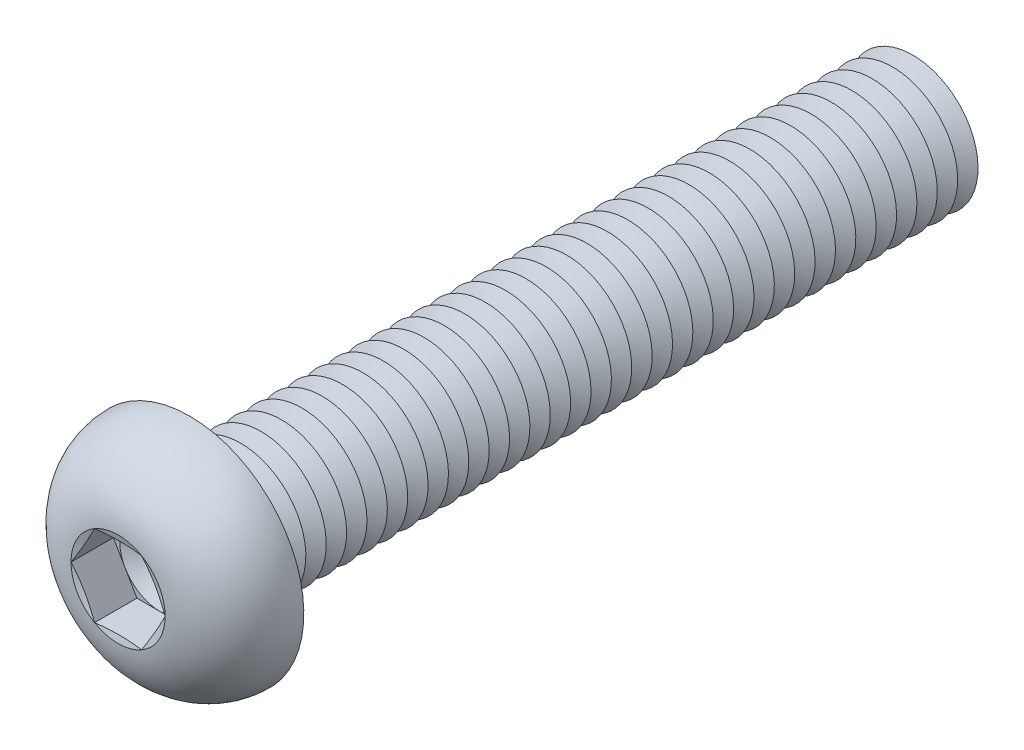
SolidWorks part; units mm, degrees
ref_plane "Front Plane" through (0, 0, 0) normal (0, 0, 1) x (1, 0, 0)
ref_plane "Top Plane" through (0, 0, 0) normal (0, 1, 0) x (1, 0, 0)
ref_plane "Right Plane" through (0, 0, 0) normal (1, 0, 0) x (0, 0, -1)
sketch "Sketch1" plane through (0, 0, 0) normal (1, 0, 0) x (0, 0, -1)
  line L0 (0, 4) -> (0, 7)
  line L3 (0, 4) -> (45, 4)
  line L4 (45, 4) -> (45, 0)
  line L5 (45, 0) -> (-4.4, 0) construction
  line L6 (-4.4, 0) -> (45, 0)
  line L7 (-4.4, 2.8867) -> (-4.4, 1.4434) construction
  line L8 (-4.4, 1.4434) -> (-4.4, 0)
  line L9 (-4.4, 2.8867) -> (-4.0132, 1.4434)
  line L10 (-4.0132, 1.4434) -> (-4.4, 1.4434)
  line L11 (45, 0) -> (22.7481, 0) construction
  line L12 (0, 7) -> (-4.4, 7) construction
  arc A1 (0, 7) -> (-4.4, 2.8867) centre (0, 2.59) ccw
  point P8 (45, 2)
  dimension "D1" = 14
  dimension "D2" = 8
  dimension "D3" = 4.4
  dimension "D4" = 5.7735
  dimension "D5" = 45
  dimension "D6" = 15
revolve "Revolve1" add sketch "Sketch1" angle 360 about L5
fillet "Fillet1" radius 0.625 1 edges at (0, 4, 0)
sketch "Sketch2" plane through (0, 0, 0) normal (1, 0, 0) x (0, 0, -1)
  line L0 (44.375, 4) -> (45.625, 4)
  line L1 (45, 4) -> (0.625, 4) construction
  line L2 (45.625, 4) -> (45, 2.9175)
  line L3 (45, -4) -> (45, 4) construction
  line L4 (45, 2.9175) -> (44.375, 4)
  dimension "D1" = 1.25
revolve "Cut-Revolve1" cut sketch "Sketch2" angle 360 about axis through (0, 0, -45) along (0, 0, -1)
pattern_linear "LPattern1" count 36 spacing 1.25 along (0, 0, 1) of "Cut-Revolve1"
sketch "Sketch3" plane through (0, 0, 4.4) normal (0, 0, 1) x (1, 0, 0)
  line L7 (1.4434, 2.5) -> (-1.4434, 2.5)
  line L8 (-1.4434, 2.5) -> (-2.8867, 0)
  line L9 (-2.8867, 0) -> (-1.4434, -2.5)
  line L10 (-1.4434, -2.5) -> (1.4434, -2.5)
  line L11 (1.4434, -2.5) -> (2.8867, 0)
  line L12 (2.8867, 0) -> (1.4434, 2.5)
  circle A0 centre (0, 0) radius 2.5 construction
  circle A3 centre (0, 0) radius 2.8867 construction
extrude "Cut-Extrude1" cut sketch "Sketch3" against normal blind 2.6
sketch "Sketch4" plane through (0, 0, 1.8) normal (0, 0, 1) x (1, 0, 0)
  line L1 (1.4434, 2.5) -> (-1.4434, 2.5) construction
  circle A0 centre (0, 0) radius 2.5
extrude "Cut-Extrude2" cut sketch "Sketch4" against normal through all draft 60
